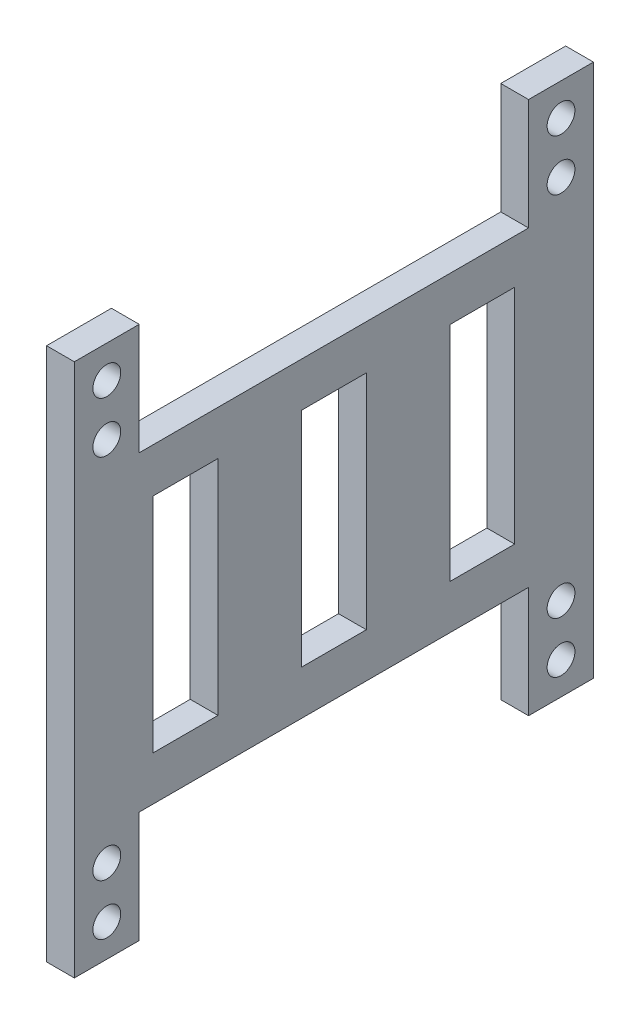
SolidWorks part; units mm, degrees
ref_plane "Front Plane" through (0, 0, 0) normal (0, 0, 1) x (1, 0, 0)
ref_plane "Top Plane" through (0, 0, 0) normal (0, 1, 0) x (1, 0, 0)
ref_plane "Right Plane" through (0, 0, 0) normal (1, 0, 0) x (0, 0, -1)
sketch "Sketch2" plane through (0, 0, 0) normal (1, 0, 0) x (0, 0, -1)
  line L0 (-28, 0) -> (31.8543, 0)
  line L1 (-28, -16.785) -> (28, -16.785)
  line L2 (-28, -16.785) -> (-28, 16.785)
  line L3 (-28, 16.785) -> (28, 16.785)
  line L4 (28, -16.785) -> (28, 16.785)
  line L5 (-28, -16.785) -> (28, 16.785) construction
  line L6 (-28, 16.785) -> (28, -16.785) construction
  line L7 (-28, 16.785) -> (-21, 16.785)
  line L8 (-28, 16.785) -> (-28, 28.785)
  line L9 (-28, 28.785) -> (-21, 28.785)
  line L10 (-21, 16.785) -> (-21, 28.785)
  line L11 (28, 16.785) -> (21, 16.785)
  line L12 (28, 16.785) -> (28, 28.785)
  line L13 (28, 28.785) -> (21, 28.785)
  line L14 (21, 16.785) -> (21, 28.785)
  line L15 (28, -16.785) -> (21, -16.785)
  line L16 (28, -16.785) -> (28, -28.785)
  line L17 (28, -28.785) -> (21, -28.785)
  line L18 (21, -16.785) -> (21, -28.785)
  line L19 (-28, -16.785) -> (-21, -16.785)
  line L20 (-28, -16.785) -> (-28, -28.785)
  line L21 (-28, -28.785) -> (-21, -28.785)
  line L22 (-21, -16.785) -> (-21, -28.785)
  line L23 (0, 32.8931) -> (0, -31.5654)
  circle A8 centre (-24.5, 25.285) radius 1.5
  circle A9 centre (-24.5, 19.785) radius 1.5
  circle A10 centre (24.5, 19.785) radius 1.5
  circle A11 centre (24.5, 25.285) radius 1.5
  circle A12 centre (24.5, -19.785) radius 1.5
  circle A13 centre (24.5, -25.285) radius 1.5
  circle A14 centre (-24.5, -19.785) radius 1.5
  circle A15 centre (-24.5, -25.285) radius 1.5
  point P0 (0, 0)
  point P50 (0, 16.3639)
  dimension "D13" = 5.5
  dimension "D11" = 3
  dimension "D1" = 33.57
  dimension "D2" = 56
  dimension "D3" = 12
  dimension "D4" = 12
  dimension "D5" = 12
  dimension "D6" = 12
  dimension "D7" = 7
  dimension "D8" = 7
  dimension "D9" = 7
  dimension "D10" = 7
  dimension "D12" = 3.5
extrude "Boss-Extrude1" add sketch "Sketch2" along normal blind 3
sketch "Sketch3" plane through (3, 0, 0) normal (1, 0, 0) x (0, 0, -1)
  line L0 (-28, 0) -> (31.8543, 0) construction
  line L1 (-3.5, -12) -> (3.5, -12)
  line L2 (-3.5, -12) -> (-3.5, 12)
  line L3 (-3.5, 12) -> (3.5, 12)
  line L4 (3.5, -12) -> (3.5, 12)
  line L5 (-3.5, -12) -> (3.5, 12) construction
  line L6 (-3.5, 12) -> (3.5, -12) construction
  line L7 (-19.5, -12) -> (-12.5, -12)
  line L8 (-19.5, -12) -> (-19.5, 12)
  line L9 (-19.5, 12) -> (-12.5, 12)
  line L10 (-12.5, -12) -> (-12.5, 12)
  line L11 (-19.5, -12) -> (-12.5, 12) construction
  line L12 (-19.5, 12) -> (-12.5, -12) construction
  line L14 (12.5, -12) -> (19.5, -12)
  line L15 (12.5, -12) -> (12.5, 12)
  line L16 (12.5, 12) -> (19.5, 12)
  line L17 (19.5, -12) -> (19.5, 12)
  line L18 (12.5, -12) -> (19.5, 12) construction
  line L19 (12.5, 12) -> (19.5, -12) construction
  point P0 (0, 0)
  point P6 (-16, 0)
  point P13 (16, 0)
  dimension "D1" = 7
  dimension "D2" = 24
  dimension "D3" = 9
  dimension "D4" = 9
extrude "Cut-Extrude1" cut sketch "Sketch3" against normal blind 10
